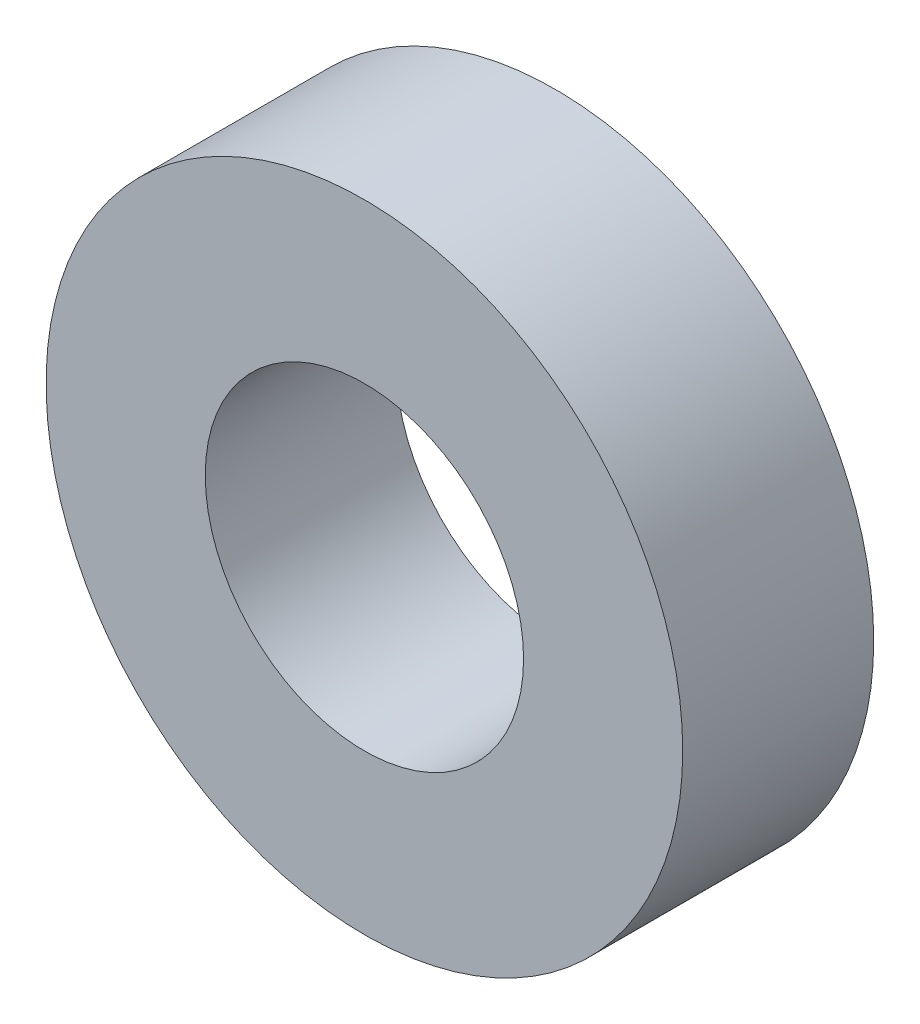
SolidWorks part; units mm, degrees
ref_plane "Front Plane" through (0, 0, 0) normal (0, 0, 1) x (1, 0, 0)
ref_plane "Top Plane" through (0, 0, 0) normal (0, 1, 0) x (1, 0, 0)
ref_plane "Right Plane" through (0, 0, 0) normal (1, 0, 0) x (0, 0, -1)
sketch "Sketch1" plane through (0, 0, 0) normal (0, 0, 1) x (1, 0, 0)
  circle A0 centre (0, 0) radius 10
  circle A1 centre (0, 0) radius 5
  dimension "D1" = 20
  dimension "D2" = 10
extrude "Extrude1" add sketch "Sketch1" along normal blind 6
